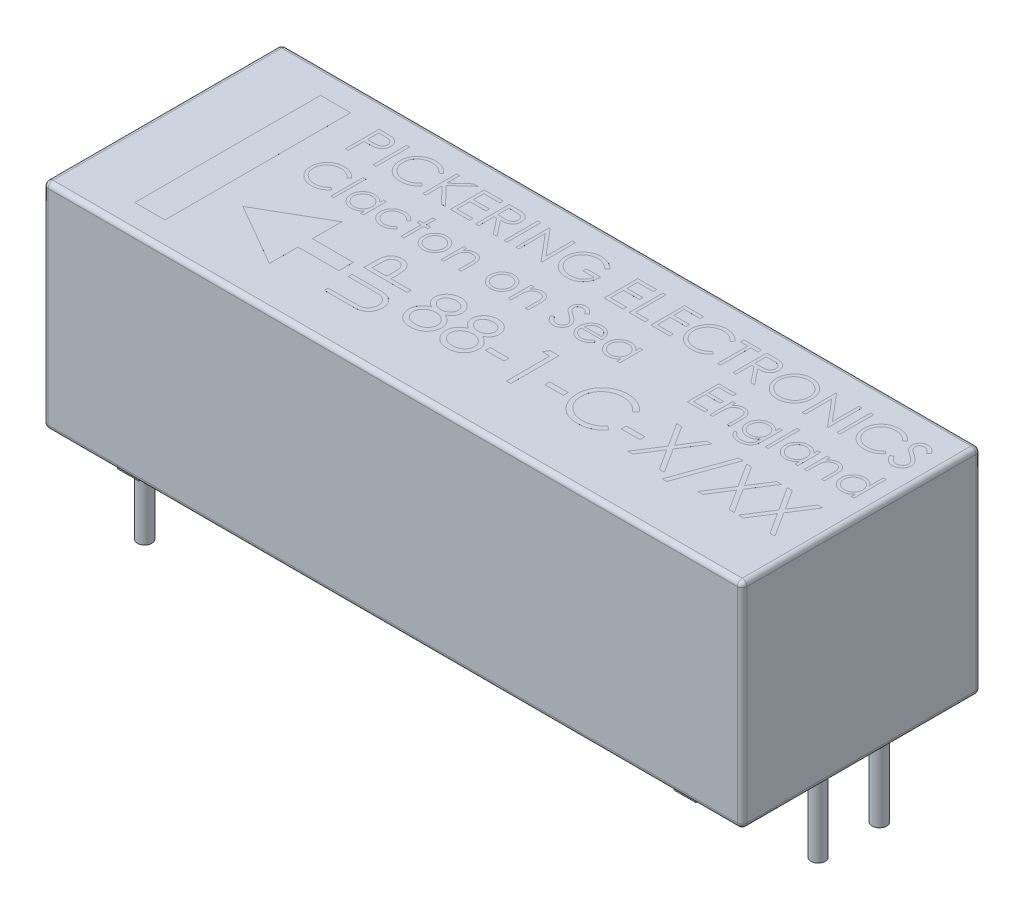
SolidWorks part; units mm, degrees
ref_plane "Front Plane" through (0, 0, 0) normal (0, 0, 1) x (1, 0, 0)
ref_plane "Top Plane" through (0, 0, 0) normal (0, 1, 0) x (1, 0, 0)
ref_plane "Right Plane" through (0, 0, 0) normal (1, 0, 0) x (0, 0, -1)
sketch "Sketch2" plane through (0, 0, 0) normal (0, 1, 0) x (1, 0, 0)
  line L1 (14.5, -4.95) -> (-14.5, -4.95)
  line L2 (14.5, -4.95) -> (14.5, 4.95)
  line L3 (14.5, 4.95) -> (-14.5, 4.95)
  line L4 (-14.5, -4.95) -> (-14.5, 4.95)
  line L5 (14.5, -4.95) -> (-14.5, 4.95) construction
  line L6 (14.5, 4.95) -> (-14.5, -4.95) construction
  point P0 (0, 0)
  dimension "D1" = 9.9
  dimension "D2" = 29
extrude "Main Body" add sketch "Sketch2" along normal blind 8.89 draft 0.023
sketch "Sketch3"
  dimension "D1" = 1.25
  dimension "D2" = 7.7
  dimension "D3" = 1.0965
  dimension "D4" = 2.7
  dimension "D5" = 1.4
  dimension "D6" = 2
extrude "Lettering" add sketch "Sketch3" along normal blind 0.0001
sketch "Sketch4" plane through (0, 0, 0) normal (0, -1, 0) x (1, 0, 0)
  line L0 (-14.5, -4.95) -> (-14.5, 4.95) construction
  line L1 (-12, 4.375) -> (-11.1, 4.375)
  line L2 (-12, 4.375) -> (-12, -4.375)
  line L3 (-12, -4.375) -> (-11.1, -4.375)
  line L4 (-11.1, 4.375) -> (-11.1, -4.375)
  line L5 (-14.5, 4.95) -> (14.5, 4.95) construction
  dimension "D1" = 8.75
  dimension "D2" = 0.9
  dimension "D3" = 2.5
  dimension "D4" = 0.575
extrude "Bobbin feet" add sketch "Sketch4" along normal blind 0.51
sketch "Sketch5" plane through (0, -0.51, 0) normal (0, -1, 0) x (1, 0, 0)
  line L0 (-11.1, -4.375) -> (-11.1, 4.375) construction
  line L1 (-11.1, -2.9375) -> (-12, -2.9375)
  line L2 (-11.1, -2.9375) -> (-11.1, -1.9375)
  line L3 (-11.1, -1.9375) -> (-12, -1.9375)
  line L4 (-12, -2.9375) -> (-12, -1.9375)
  line L5 (-12, 4.375) -> (-12, -4.375) construction
  line L6 (-12, 4.375) -> (-12, -4.375) construction
  line L7 (-12, -0.5) -> (-11.1, -0.5)
  line L8 (-12, -0.5) -> (-12, 0.5)
  line L9 (-12, 0.5) -> (-11.1, 0.5)
  line L10 (-11.1, -0.5) -> (-11.1, 0.5)
  line L11 (-11.1, 1.9375) -> (-12, 1.9375)
  line L12 (-11.1, 1.9375) -> (-11.1, 2.9375)
  line L13 (-11.1, 2.9375) -> (-12, 2.9375)
  line L14 (-12, 1.9375) -> (-12, 2.9375)
  line L15 (-12, -4.375) -> (-11.1, -4.375) construction
  dimension "D1" = 1.4375
  dimension "D2" = 1
  dimension "D3" = 1.4375
  dimension "D4" = 1
  dimension "D5" = 1
  dimension "D6" = 1.4375
extrude "Bobbin feet cut" cut sketch "Sketch5" against normal up to surface (0.51 mm away)
sketch "Sketch8" plane through (0, 0, 0) normal (0, -1, 0) x (1, 0, 0)
  line L0 (-14.5, -4.95) -> (-14.5, 4.95) construction
  line L1 (-12, -4.375) -> (-13.925, -4.375)
  line L2 (-12, -4.375) -> (-12, -2.9375)
  line L3 (-12, -2.9375) -> (-13.925, -2.9375)
  line L4 (-13.925, -4.375) -> (-13.925, -2.9375)
  line L5 (-12, -2.9375) -> (-11.1, -2.9375) construction
  dimension "D1" = 0.575
extrude "Extrude5" add sketch "Sketch8" along normal blind 0.1
pattern_linear "LPattern1" count 4 spacing 2.4385 along (0, 0, 1) of "Extrude5"
mirror "Mirror1" about plane through (0, 0, 0) normal (1, 0, 0) of "Extrude5", "Bobbin feet cut", "Bobbin feet", "LPattern1"
sketch "Sketch9" plane through (0, 0, 0) normal (0, -1, 0) x (1, 0, 0)
  line L0 (14.5, -4.95) -> (-14.5, -4.95) construction
  line L1 (14.5, 4.95) -> (14.5, -4.95) construction
  circle A0 centre (12.7, -2.54) radius 0.3
  circle A1 centre (12.7, 0) radius 0.2963
  dimension "D1" = 0.6
  dimension "D2" = 2.41
  dimension "D3" = 2.54
  dimension "D4" = 1.8
extrude "Pins" add sketch "Sketch9" along normal blind 4.31
mirror "Mirror2" about plane through (0, 0, 0) normal (1, 0, 0) of "Pins"
sketch "Sketch10" plane through (0, 0, 0) normal (0, -1, 0) x (1, 0, 0)
  line L0 (-14.5, 4.95) -> (14.5, 4.95) construction
  line L3 (-14.5, -4.95) -> (-14.5, 4.95) construction
  circle A0 centre (-12.7, 2.54) radius 0.3
  dimension "D1" = 0.6
  dimension "D2" = 2.41
  dimension "D3" = 1.8
extrude "Form c pin" add sketch "Sketch10" along normal blind 4.31
fillet "Fillet1" radius 0.2 12 edges at (14.4983, 4.445, -4.9483) (0, 8.89, -4.9465) (-14.4983, 4.445, -4.9483) (0, 0, -4.95) (-14.4983, 4.445, 4.9483) (0, 8.89, 4.9465) (14.4983, 4.445, 4.9483) (0, 0, 4.95) (-14.5, 0, 0) (14.5, 0, 0) (-14.4965, 8.89, 0) (14.4965, 8.89, 0)
sketch "Sketch11"
sketch_block_instance "UP-2"
sketch_block "UP"
sketch_block_instance "Block1-1"
sketch_block "Block1" parameters "D1"=1.7, "D2"=2.2, "D3"=2.6, "D4"=1.24
extrude "Extrude6" add sketch "Sketch11" along normal blind 0.0001
